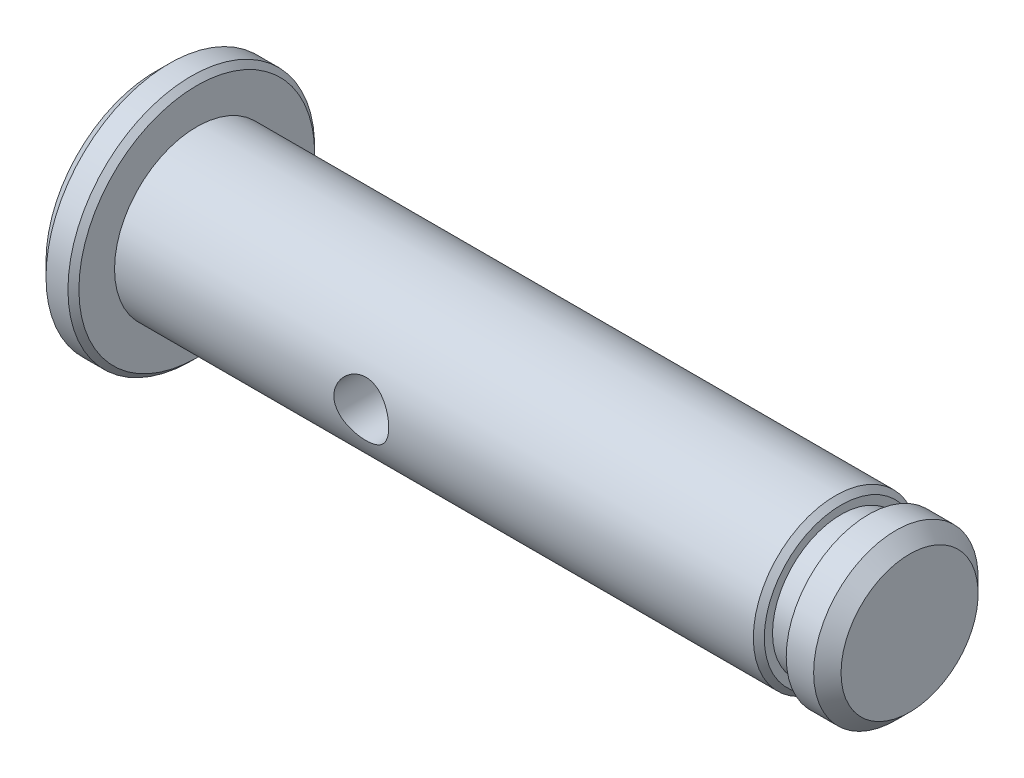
SolidWorks part; units mm, degrees
ref_plane "前视" through (0, 0, 0) normal (0, 0, 1) x (1, 0, 0)
ref_plane "上视" through (0, 0, 0) normal (0, 1, 0) x (1, 0, 0)
ref_plane "右视" through (0, 0, 0) normal (1, 0, 0) x (0, 0, -1)
sketch "草图1" plane through (0, 0, 0) normal (0, 0, 1) x (1, 0, 0)
  line L0 (0, 0) -> (77.1831, 0) construction
  line L1 (0, 0) -> (0, 4.5)
  line L2 (0, 4.5) -> (1.5, 4.5)
  line L3 (1.5, 4.5) -> (1.5, 3)
  line L4 (1.5, 3) -> (25, 3)
  line L5 (25, 3) -> (25, 2.5)
  line L6 (25, 2.5) -> (26, 2.5)
  line L7 (26, 2.5) -> (26, 3)
  line L8 (26, 3) -> (27.5, 3)
  line L9 (27.5, 3) -> (27.5, 0)
  line L10 (27.5, 0) -> (0, 0)
  dimension "D1" = 1.5
  dimension "D2" = 1
  dimension "D3" = 0.5
  dimension "D4" = 6
  dimension "D5" = 1.5
  dimension "D6" = 9
  dimension "D7" = 23.5
revolve "旋转1" add sketch "草图1" angle 360 about L0
chamfer "倒角1" distance 0.5 angle 45 2 edges at (27.5, 0, 3) (0, 0, 4.5)
sketch "草图2" plane through (0, 0, 0) normal (0, 0, 1) x (1, 0, 0)
  line L0 (0, 0) -> (26.5863, 0) construction
  line L1 (1.5, -4.5) -> (1.5, 4.5) construction
  circle A0 centre (10.5, 0) radius 1
  dimension "D1" = 2
  dimension "D2" = 9
extrude "切除-拉伸1" cut sketch "草图2" against normal mid plane 30
chamfer "倒角2" distance 0.2 angle 45 2 edges at (25, 0, 3) (1.5, 0, 4.5)
